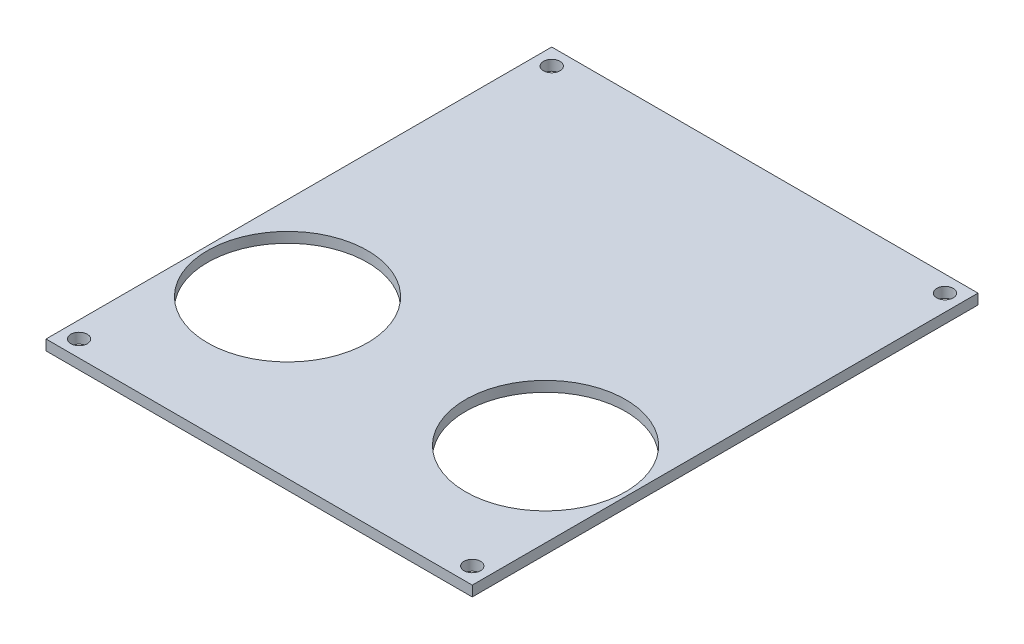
SolidWorks part; units mm, degrees
ref_plane "Front Plane" through (0, 0, 0) normal (0, 0, 1) x (1, 0, 0)
ref_plane "Top Plane" through (0, 0, 0) normal (0, 1, 0) x (1, 0, 0)
ref_plane "Right Plane" through (0, 0, 0) normal (1, 0, 0) x (0, 0, -1)
sketch "Sketch1" plane through (0, 0, 0) normal (0, 1, 0) x (1, 0, 0)
  line L1 (41.3, 49) -> (-41.3, 49)
  line L2 (41.3, 49) -> (41.3, -49)
  line L3 (41.3, -49) -> (-41.3, -49)
  line L4 (-41.3, 49) -> (-41.3, -49)
  line L5 (41.3, 49) -> (-41.3, -49) construction
  line L6 (41.3, -49) -> (-41.3, 49) construction
  point P0 (0, 0)
  dimension "D1" = 82.6
  dimension "D2" = 98
extrude "Boss-Extrude1" add sketch "Sketch1" along normal blind 2
hole_wizard "Ø3.2 (3.2) Diameter Hole1" positions "Sketch3" profile "Sketch2" hole size "Ø3.2" standard "ISO"
sketch "Sketch3" plane through (0, 2, 0) normal (0, 1, 0) x (1, 0, 0)
  line L0 (-41.3, 49) -> (-41.3, -49) construction
  line L1 (41.3, 49) -> (-41.3, 49) construction
  line L2 (41.3, -49) -> (41.3, 49) construction
  line L3 (-41.3, -49) -> (41.3, -49) construction
  point P0 (-38.1, 45.8)
  point P2 (38.1, 45.8)
  point P4 (38.1, -45.8)
  point P6 (-38.1, -45.8)
  dimension "D1" = 3.2
  dimension "D2" = 3.2
  dimension "D3" = 3.2
  dimension "D4" = 3.2
  dimension "D5" = 3.2
  dimension "D6" = 3.2
  dimension "D7" = 3.2
  dimension "D8" = 3.2
sketch "Sketch2" plane through (-38.1, 2, -45.8) normal (1, 0, 0) x (0, 0, 1)
  line L0 (0, 0) -> (0, 2)
  line L1 (0, 2) -> (1.6, 2)
  line L2 (1.6, 2) -> (1.6, 0)
  line L5 (1.6, 0) -> (0, 0)
  line L11 (0, -6.35) -> (0, 107.95) construction
  dimension "Thru Hole Dia." = 3.2
  dimension "Thru Hole Depth" = 2
sketch "Sketch4" plane through (0, 2, 0) normal (0, 1, 0) x (1, 0, 0)
  line L0 (-41.3, -49) -> (41.3, -49) construction
  line L3 (-41.3, 49) -> (-41.3, -49) construction
  circle A0 centre (-25, -18.5) radius 15.5
  circle A1 centre (25, -18.5) radius 15.5
  dimension "D1" = 31
  dimension "D2" = 31
  dimension "D3" = 30.5
  dimension "D4" = 50
  dimension "D6" = 16.3
extrude "Cut-Extrude1" cut sketch "Sketch4" against normal blind 2
